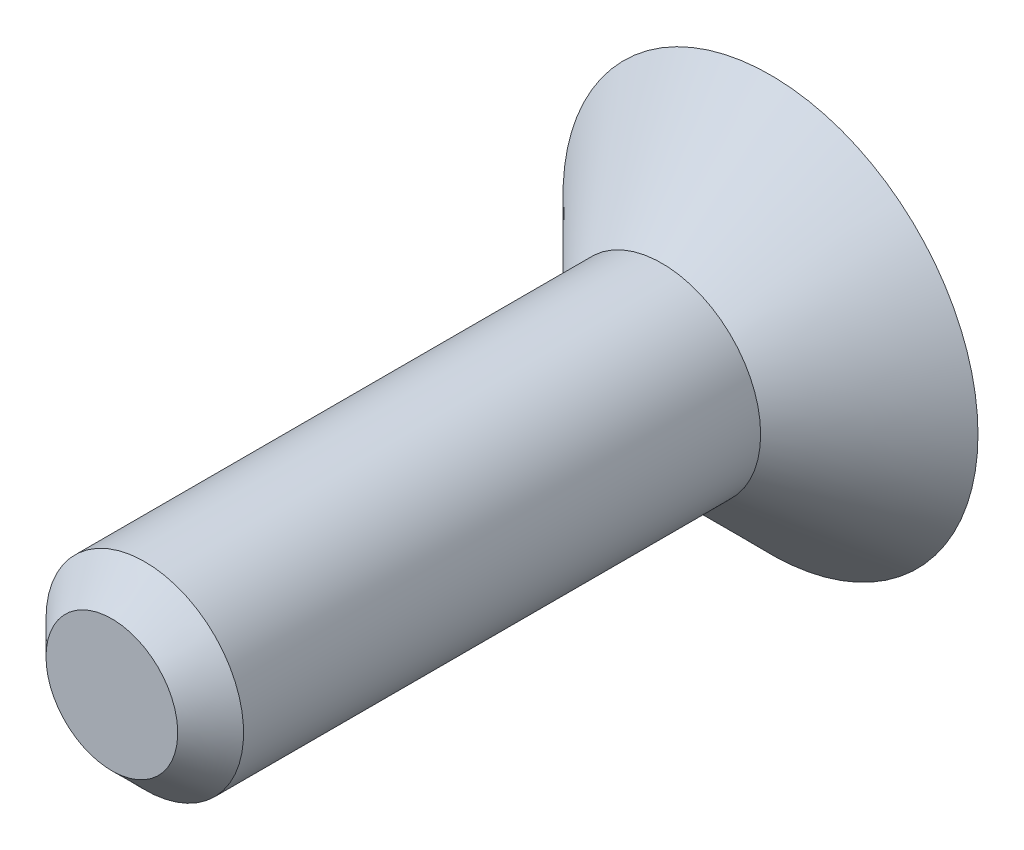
SolidWorks part; units mm, degrees
ref_plane "Plan1" through (0, 0, 0) normal (0, 0, 1) x (1, 0, 0)
ref_plane "Plan2" through (0, 0, 0) normal (0, 1, 0) x (1, 0, 0)
ref_plane "Plan3" through (0, 0, 0) normal (1, 0, 0) x (0, 0, -1)
sketch "Esquisse1" plane through (0, 0, 0) normal (0, 0, 1) x (1, 0, 0)
  circle A0 centre (0, 0) radius 3.15
  dimension "D1" = 6.3
extrude "Tête" add sketch "Esquisse1" along normal blind 2 draft 45
sketch "Esquisse2" plane through (0, 0, 0) normal (0, 0, -1) x (-1, 0, 0)
  circle A0 centre (0, 0) radius 1.5
  dimension "D1" = 3
extrude "Corps" add sketch "Esquisse2" against normal blind 10
sketch "Esquisse3" plane through (0, 0, 0) normal (0, 0, 1) x (1, 0, 0)
  line L0 (-1.05, -1.8187) -> (0.525, 0.9093) construction
  line L1 (-1.05, 1.8187) -> (2.1, 0)
  line L2 (-1.05, 1.8187) -> (-1.05, -1.8187)
  line L3 (-1.05, -1.8187) -> (2.1, 0)
  line L4 (-1.05, 1.8187) -> (0.525, -0.9093) construction
  line L5 (-1.05, 0) -> (2.1, 0) construction
  line L6 (3.15, 0) -> (2.1, 0) construction
  line L7 (0, 0) -> (-1.05, 0) construction
  circle A1 centre (0, 0) radius 3.15 construction
extrude "Empreinte" cut sketch "Esquisse3" along normal blind 0.8
chamfer "Chanfrein" distance 0.5 angle 45
